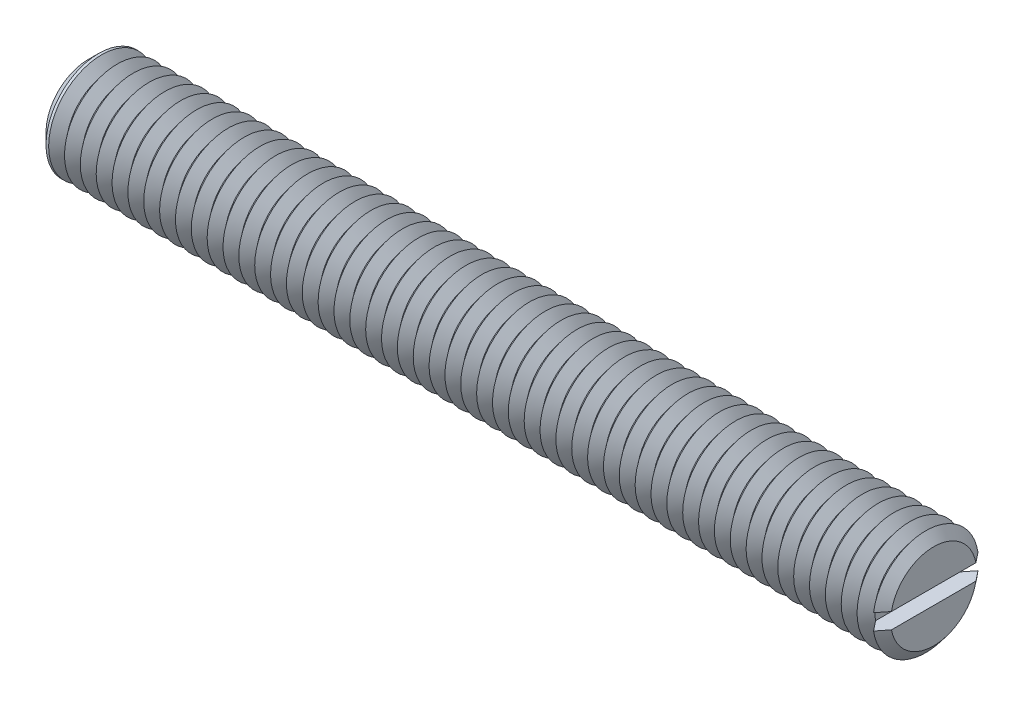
SolidWorks part; units mm, degrees
ref_plane "Front Plane" through (0, 0, 0) normal (0, 0, 1) x (1, 0, 0)
ref_plane "Top Plane" through (0, 0, 0) normal (0, 1, 0) x (1, 0, 0)
ref_plane "Right Plane" through (0, 0, 0) normal (1, 0, 0) x (0, 0, -1)
sketch "Sketch1" plane through (0, 0, 0) normal (1, 0, 0) x (0, 0, -1)
  circle A0 centre (0, 0) radius 5
  dimension "D1" = 10
extrude "Extrude1" add sketch "Sketch1" along normal mid plane 80
sketch "Sketch2" plane through (0, 0, 0) normal (0, 0, 1) x (1, 0, 0)
  line L0 (40, 0.75) -> (38.5, 0.75)
  line L1 (40, -5) -> (40, 5) construction
  line L2 (38.5, 0.75) -> (38.5, -0.75)
  line L3 (0, 0) -> (50000, 0) construction
  line L4 (40, -0.75) -> (38.5, -0.75)
  line L5 (40, -0.75) -> (40, 0.75)
  point P9 (38.5, 0)
  dimension "D1" = 1.5
extrude "Extrude2" cut sketch "Sketch2" against normal mid plane 15
chamfer "Chamfer1" distance 1 angle 45 1 edges at (-40, 0, -5)
sketch "Sketch3" plane through (0, 0, 0) normal (0, 0, 1) x (1, 0, 0)
  line L0 (0, 0) -> (30.9602, 0) construction
  line L1 (39.25, -5) -> (40.75, -5)
  line L2 (-39, -5) -> (40, -5) construction
  line L3 (40.75, -5) -> (40, -4.0633)
  line L4 (40, -5) -> (40, -0.75) construction
  line L5 (40, -4.0633) -> (39.25, -5)
  dimension "D1" = 1.5
  dimension "D2" = 1.2
revolve "Cut-Revolve1" cut sketch "Sketch3" angle 360 about L0
pattern_linear "LPattern1" count 53 spacing 1.5 along (-1, 0, 0) of "Cut-Revolve1"
equation "\"D2@Sketch3\" = \"D1@Sketch3\"*0.8"
